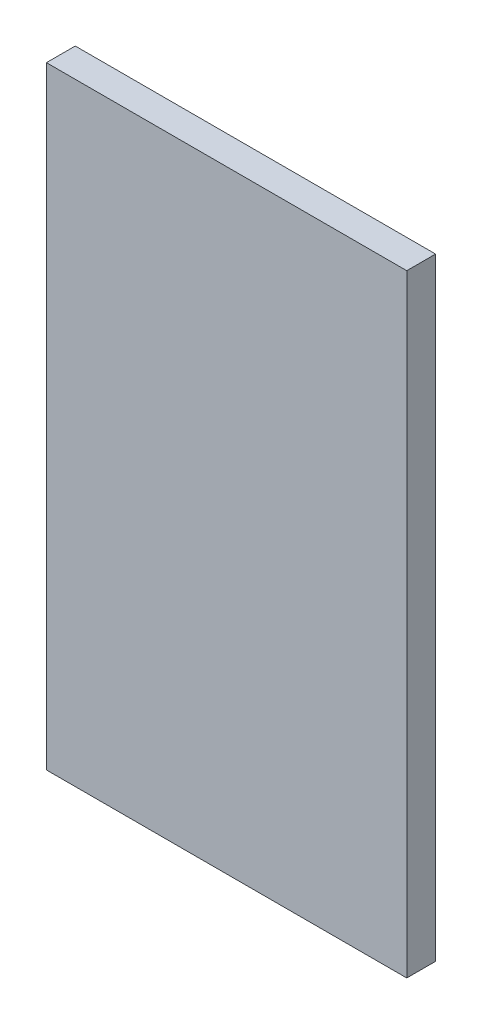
SolidWorks part; units mm, degrees
ref_plane "Front Plane" through (0, 0, 0) normal (1, 0, 0) x (0, 1, 0)
ref_plane "Top Plane" through (0, 0, 0) normal (0, 0, 1) x (0, 1, 0)
ref_plane "Right Plane" through (0, 0, 0) normal (0, 1, 0) x (-1, 0, 0)
sketch "Sketch1" plane through (0, 0, 0) normal (1, 0, 0) x (0, 1, 0)
  line L0 (0, 0) -> (34, 0)
  line L1 (34, 0) -> (34, 1.6)
  line L2 (34, 1.6) -> (0, 1.6)
  line L3 (0, 1.6) -> (0, 0)
extrude "Panel_or_block" add sketch "Sketch1" along normal blind 20
